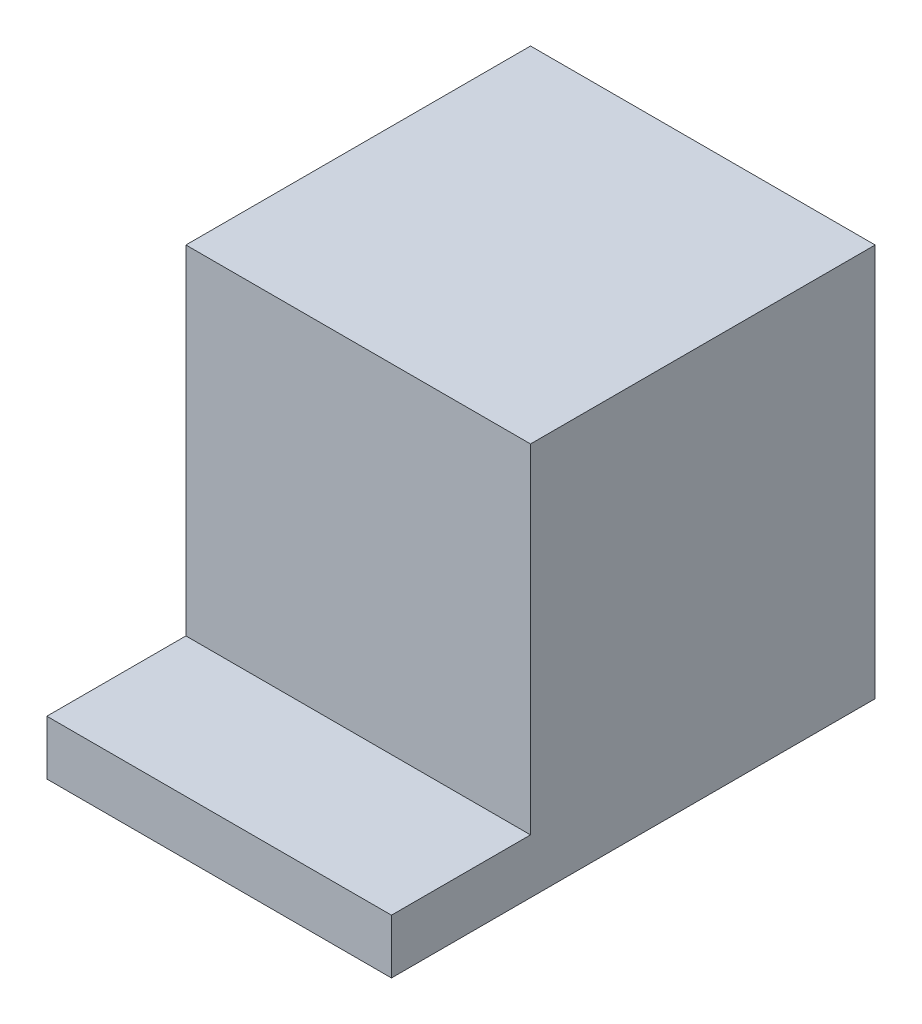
SolidWorks part; units mm, degrees
ref_plane "Front Plane" through (0, 0, 0) normal (0, 0, 1) x (1, 0, 0)
ref_plane "Top Plane" through (0, 0, 0) normal (0, 1, 0) x (1, 0, 0)
ref_plane "Right Plane" through (0, 0, 0) normal (1, 0, 0) x (0, 0, -1)
sketch "Sketch1" plane through (0, 0, 0) normal (0, 1, 0) x (1, 0, 0)
  line L1 (0, 0) -> (57, 0)
  line L2 (0, 0) -> (0, 80)
  line L3 (0, 80) -> (57, 80)
  line L4 (57, 0) -> (57, 80)
  dimension "D1" = 80
  dimension "D2" = 57
extrude "Boss-Extrude1" add sketch "Sketch1" along normal blind 9
sketch "Sketch2" plane through (0, 9, 0) normal (0, 1, 0) x (1, 0, 0)
  line L1 (0, 80) -> (57, 80)
  line L2 (0, 80) -> (0, 23)
  line L3 (0, 23) -> (57, 23)
  line L4 (57, 80) -> (57, 23)
  dimension "D1" = 57
  dimension "D2" = 57
extrude "Boss-Extrude2" add sketch "Sketch2" along normal blind 56
